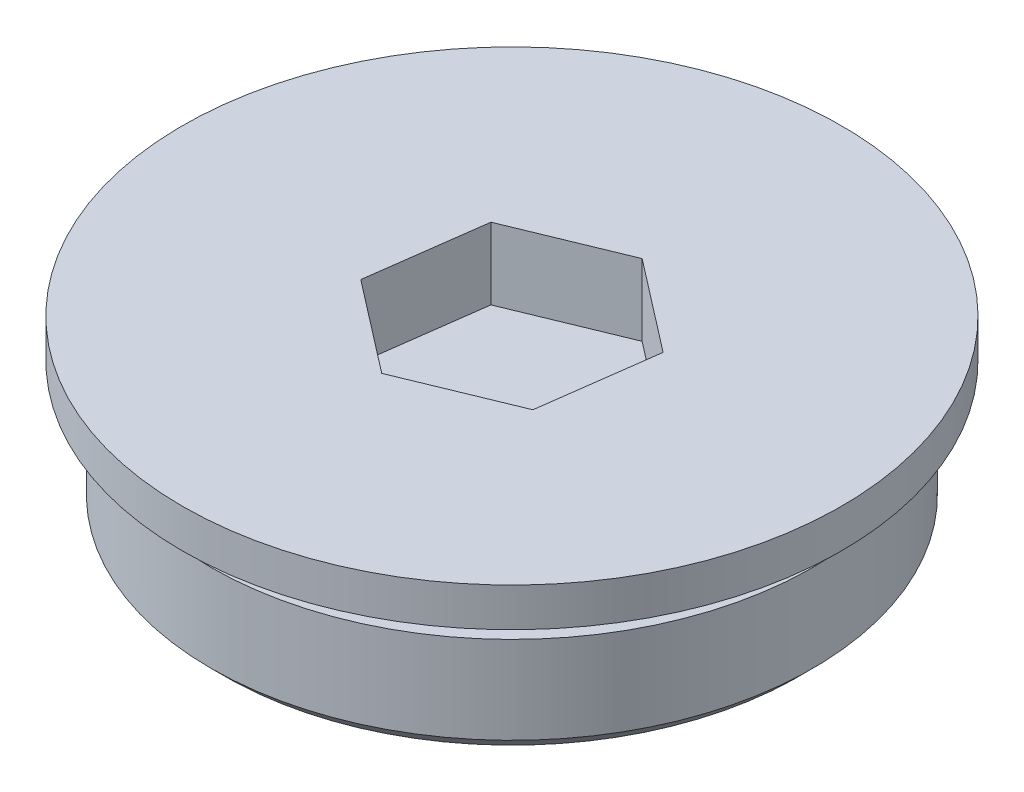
SolidWorks part; units mm, degrees
ref_plane "Plan1" through (0, 0, 0) normal (0, 0, 1) x (1, 0, 0)
ref_plane "Plan2" through (0, 0, 0) normal (0, 1, 0) x (1, 0, 0)
ref_plane "Plan3" through (0, 0, 0) normal (1, 0, 0) x (0, 0, -1)
sketch "Esquisse1" plane through (0, 0, 0) normal (0, 0, 1) x (1, 0, 0)
  line L0 (0, 63) -> (0, -38) construction
  line L1 (0, 0) -> (-19, 0)
  line L2 (-19, 0) -> (-19, -2)
  line L3 (-19, -2) -> (-21, -2)
  line L4 (-21, -2) -> (-21, 5.1)
  line L5 (-21, 5.1) -> (-20, 5.1)
  line L6 (-20, 5.1) -> (-20, 7.1)
  line L7 (-20, 7.1) -> (-23, 7.1)
  line L8 (-23, 7.1) -> (-23, 9.8)
  line L9 (-23, 9.8) -> (0, 9.8)
  line L10 (0, 9.8) -> (0, 0)
  dimension "D1" = 40
  dimension "D2" = 38
  dimension "D3" = 42
  dimension "D4" = 46
  dimension "D5" = 2
  dimension "D6" = 7.1
  dimension "D7" = 2
  dimension "D8" = 2.7
revolve "Base-Révolution" add sketch "Esquisse1" angle 360 about L0
chamfer "Chanfrein1" distance 1 angle 45
sketch "Esquisse2" plane through (0, 9.8, 0) normal (0, 1, 0) x (-1, 0, 0)
  line L1 (1.0753, 8.0111) -> (-6.4001, 4.9368)
  line L2 (-6.4001, 4.9368) -> (-7.4754, -3.0743)
  line L3 (-7.4754, -3.0743) -> (-1.0753, -8.0111)
  line L4 (-1.0753, -8.0111) -> (6.4001, -4.9368)
  line L5 (6.4001, -4.9368) -> (7.4754, 3.0743)
  line L6 (7.4754, 3.0743) -> (1.0753, 8.0111)
  circle A0 centre (0, 0) radius 7 construction
  circle A1 centre (0, 0) radius 23 construction
  dimension "D1" = 14
extrude "Enlèv. mat.-Extru.1" cut sketch "Esquisse2" against normal blind 5
